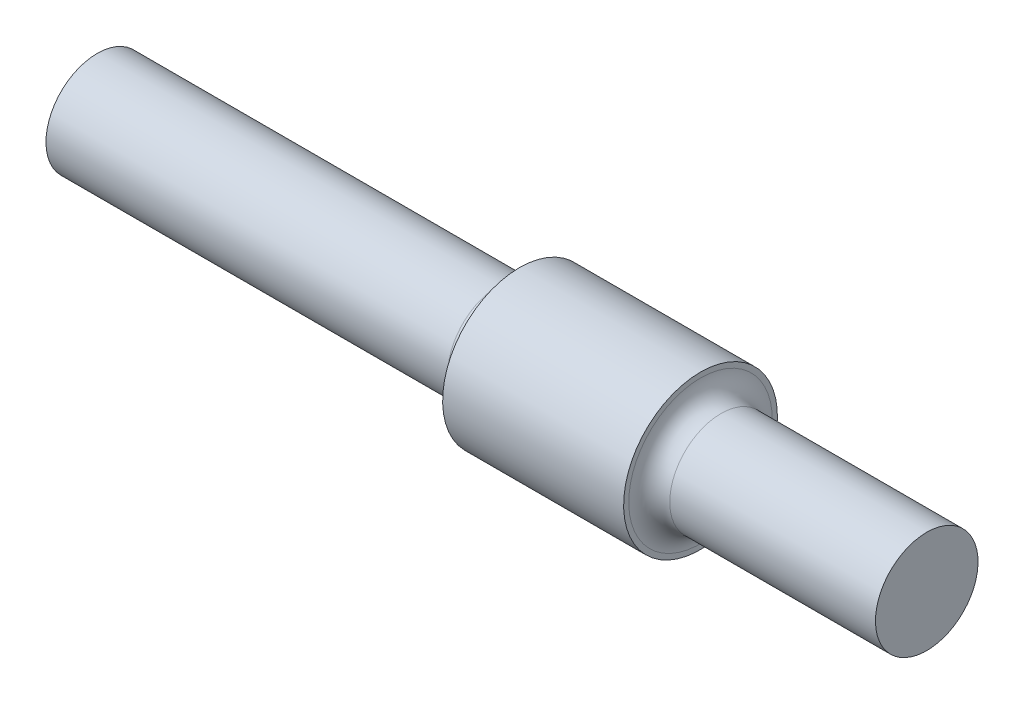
SolidWorks part; units mm, degrees
ref_plane "Front Plane" through (0, 0, 0) normal (0, 0, 1) x (1, 0, 0)
ref_plane "Top Plane" through (0, 0, 0) normal (0, 1, 0) x (1, 0, 0)
ref_plane "Right Plane" through (0, 0, 0) normal (1, 0, 0) x (0, 0, -1)
sketch "Sketch1" plane through (0, 0, 0) normal (0, 0, 1) x (1, 0, 0)
  line L0 (0, 12.75) -> (0, 21.25)
  line L1 (0, 21.25) -> (70, 21.25)
  line L2 (70, 21.25) -> (70, 25.5)
  line L3 (70, 25.5) -> (100, 25.5)
  line L4 (100, 25.5) -> (100, 21.25)
  line L5 (100, 21.25) -> (137.5, 21.25)
  line L6 (137.5, 21.25) -> (137.5, 12.75)
  line L7 (137.5, 12.75) -> (0, 12.75)
  line L8 (0, 0) -> (0, 25.5) construction
revolve "Revolve1" add sketch "Sketch1" angle 360 about L7
fillet "Fillet1" radius 3.4 2 edges at (100, 21.25, 0) (70, 21.25, 0)
sketch "Sketch2" plane through (0, 0, 0) normal (0, 1, 0) x (1, 0, 0)
  line L0 (94, 1) -> (76, 1)
  line L1 (76, -1) -> (94, -1)
  line L2 (76, 0) -> (70, 0) construction
  line L3 (70, 11.9) -> (70, -11.9) construction
  line L4 (94, 0) -> (100, 0) construction
  line L5 (100, -12.75) -> (100, 12.75) construction
  arc A0 (76, 1) -> (76, -1) centre (76, 0) ccw
  arc A1 (94, -1) -> (94, 1) centre (94, 0) ccw
extrude "Cut-Extrude1" cut sketch "Sketch2" along normal blind 1
equation "\"shaft diameter\"= 17mm"
equation "\"facewidth\"= 20mm"
equation "\"D1@Fillet1\"=\"shaft diameter\" / 5"
equation "\"D5@Sketch1\"= 1.5 * \"shaft diameter\""
equation "\"keywidth\"= 2mm"
equation "\"key height\"= 2mm"
equation "\"D1@Sketch2\"= \"keywidth\""
equation "\"D2@Sketch2\"= \"facewidth\" - \"keywidth\""
equation "\"D1@Cut-Extrude1\"= \"key height\" / 2"
equation "\"D2@Sketch1\"= \"facewidth\" + 10"
equation "\"D3@Sketch1\"= \"shaft diameter\" /2"
equation "\"D4@Sketch1\"= 0.25 *\"shaft diameter\""
